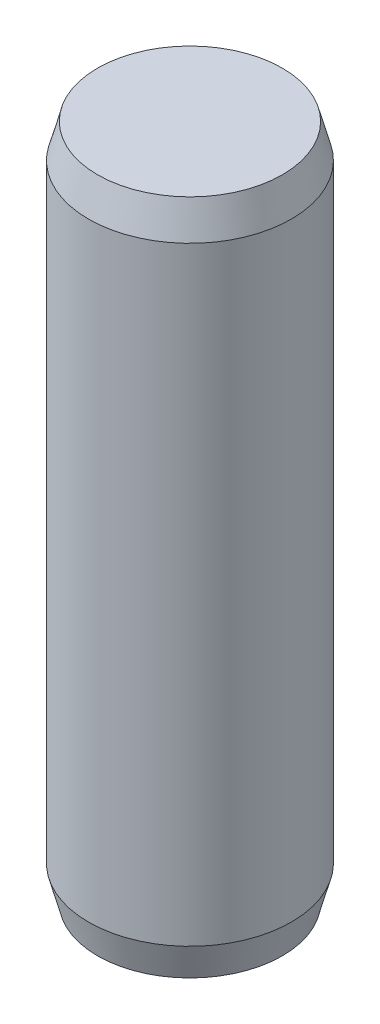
SolidWorks part; units mm, degrees
ref_plane "Plan1" through (0, 0, 0) normal (0, 0, 1) x (1, 0, 0)
ref_plane "Plan2" through (0, 0, 0) normal (0, 1, 0) x (1, 0, 0)
ref_plane "Plan3" through (0, 0, 0) normal (1, 0, 0) x (0, 0, -1)
sketch "Esquisse1" plane through (0, 0, 0) normal (0, 0, 1) x (1, 0, 0)
  line L1 (1.5, -9.5) -> (1.5, -0.5)
  line L2 (0, 0) -> (0, -20.7306) construction
  line L3 (1.5, -9.5) -> (1.366, -10)
  line L4 (0, 0) -> (0, -10)
  line L5 (0, -10) -> (1.366, -10)
  line L6 (-4.4759, 0) -> (-1.4759, 0) construction
  line L7 (0, 0) -> (1.366, 0)
  line L8 (1.5, -0.5) -> (1.366, 0)
  dimension "D1" = 15
  dimension "D2" = 15
  dimension "Longueur" = 10
  dimension "Hauteur chamfrein" = 0.5
  dimension "Rn" = 1.5
  dimension "Diamètre nominal" = 3
revolve "Base-Révolution" add sketch "Esquisse1" angle 360 about L2
equation "\"Rn@Esquisse1\" = \"Diamètre nominal@Esquisse1\"/2"
